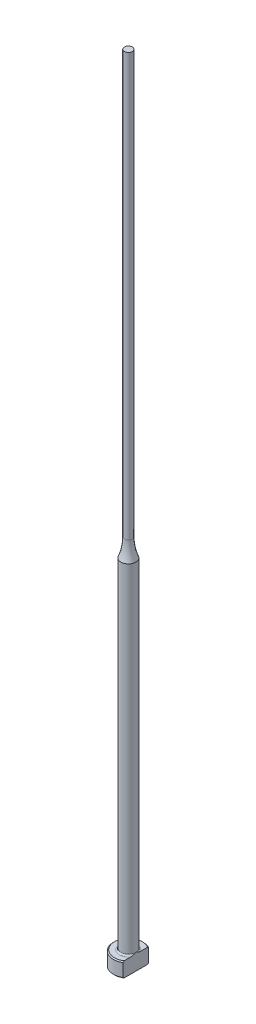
SolidWorks part; units mm, degrees
ref_plane "Front Plane" through (0, 0, 0) normal (0, 0, 1) x (1, 0, 0)
ref_plane "Top Plane" through (0, 0, 0) normal (0, 1, 0) x (1, 0, 0)
ref_plane "Right Plane" through (0, 0, 0) normal (1, 0, 0) x (0, 0, -1)
sketch "Sketch1" plane through (0, 0, 0) normal (0, 0, 1) x (1, 0, 0)
  line L0 (0, 259.9588) -> (0, -15.1925) construction
  line L1 (0, 0) -> (-3, 0)
  line L2 (-3, 0) -> (-3, 3)
  line L3 (-3, 3) -> (-1.5, 3)
  line L4 (-0.8, 75) -> (-0.8, 160)
  line L5 (-0.8, 160) -> (0, 160)
  line L6 (0, 160) -> (0, 0)
  line L7 (-1.5, 3) -> (-1.5, 71.3244)
  arc A0 (-1.5, 71.3244) -> (-0.8, 75) centre (-10.8, 75) ccw
  point P13 (-1.5, 0)
  dimension "D1" = 10
  dimension "L" = 160
  dimension "H" = 6
  dimension "T" = 3
  dimension "D" = 1.6
  dimension "B" = 3
  dimension "S" = 75
revolve "Revolve1" add sketch "Sketch1" angle 360 about L0
chamfer "Chamfer1" distance 0.2 angle 45 2 edges at (0, 3, 3) (0, 0, 3)
fillet "Fillet1" radius 0.3 1 edges at (0, 3, 1.5)
sketch "Sketch2" plane through (0, 0, 0) normal (0, 1, 0) x (1, 0, 0)
  line L0 (1.5, 2.5981) -> (1.5, -2.5981)
  circle A0 centre (0, 0) radius 3 construction
  arc A1 (1.5, -2.5981) -> (1.5, 2.5981) centre (0, 0) ccw
  circle A2 centre (0, 0) radius 1.5 construction
extrude "KEY" cut sketch "Sketch2" along normal through all
